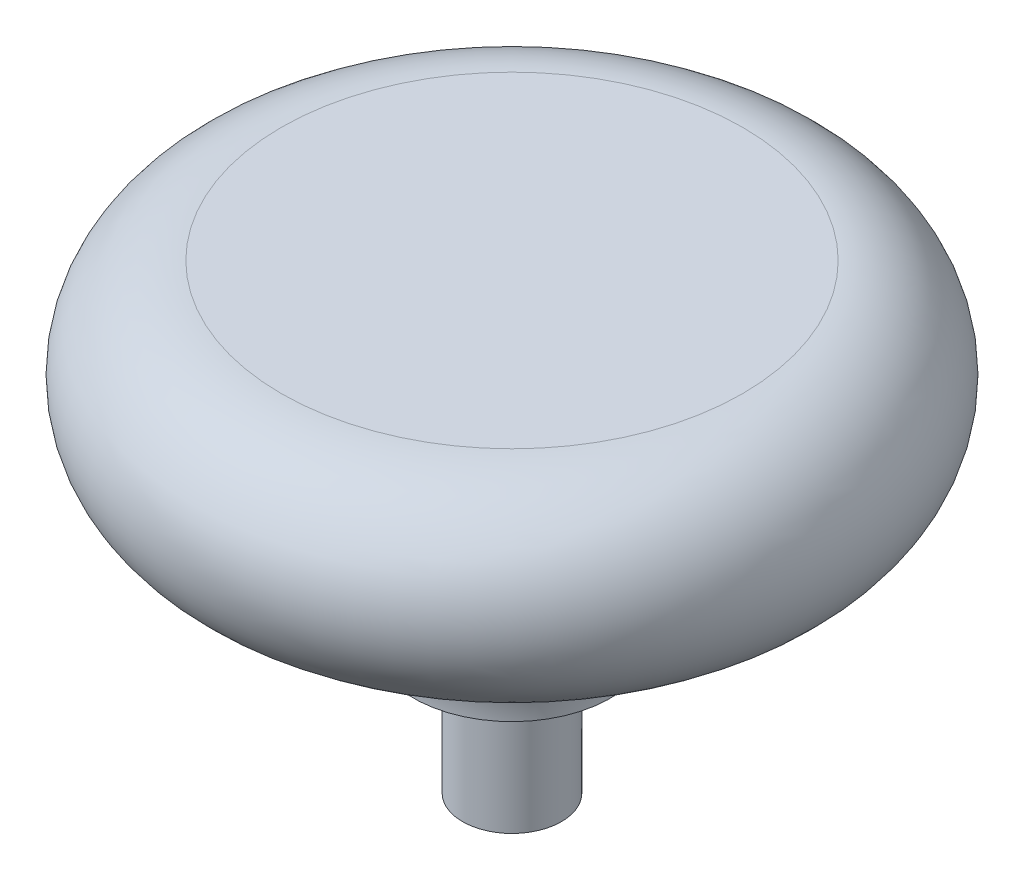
SolidWorks part; units mm, degrees
revolve "Base-Revolve" add sketch "Sketch1" angle 360 about L0
sketch "Sketch1" plane through (0, 0, 0) normal (0, 0, 1) x (1, 0, 0)
  line L0 (0, 0) -> (0, 36.2882) construction
  line L1 (0, 0) -> (0, 22.225)
  line L2 (0, 22.225) -> (11.1125, 22.225)
  line L4 (4.7625, 6.35) -> (2.3813, 6.35)
  line L5 (2.3813, 6.35) -> (2.3812, 0)
  line L6 (2.3812, 0) -> (0, 0)
  arc A0 (11.1125, 22.225) -> (11.1125, 12.7) centre (11.1125, 17.4625) cw
  arc A1 (11.1125, 12.7) -> (4.7625, 6.35) centre (11.1125, 6.35) ccw
  dimension "D5" = 6.35
  dimension "D6" = 4.7625
  dimension "D1" = 2.3813
  dimension "D2" = 4.7625
  dimension "D3" = 6.35
  dimension "D4" = 15.875
ref_plane "Front" through (0, 0, 0) normal (0, 0, 1) x (1, 0, 0)
ref_plane "Top" through (0, 0, 0) normal (0, 1, 0) x (-1, 0, 0)
ref_plane "Right" through (0, 0, 0) normal (1, 0, 0) x (0, 0, -1)
